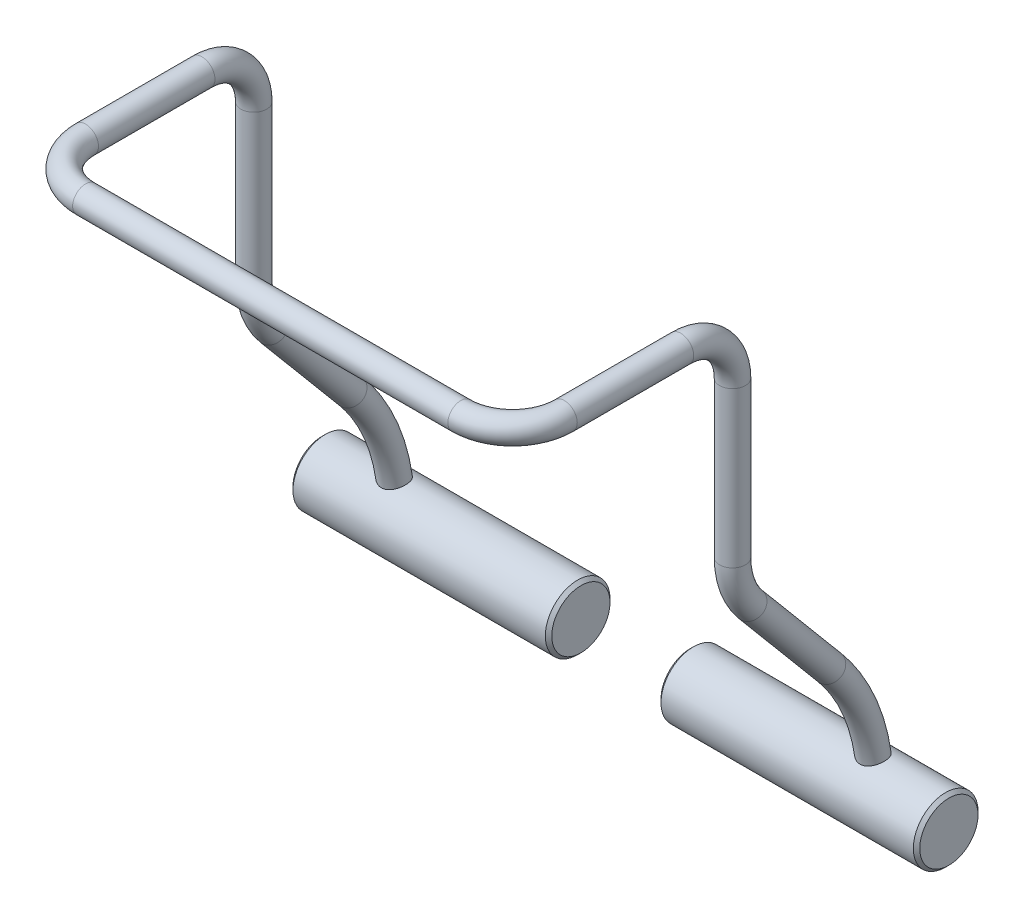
SolidWorks part; units mm, degrees
ref_plane "Face" through (0, 0, 0) normal (0, 0, 1) x (1, 0, 0)
ref_plane "Dessus" through (0, 0, 0) normal (0, 1, 0) x (1, 0, 0)
ref_plane "Droite" through (0, 0, 0) normal (1, 0, 0) x (0, 0, -1)
sketch "Esquisse1" plane through (0, 0, 0) normal (1, 0, 0) x (0, 0, -1)
  line L0 (0, 0) -> (0, 0.2473)
  line L1 (-9.5963, 17.1433) -> (-3.5093, 9.8891)
  line L2 (-11, 33) -> (-11, 21)
  line L3 (-15, 37) -> (-24, 37)
  arc A0 (-15, 37) -> (-11, 33) centre (-15, 33) cw
  arc A1 (-11, 21) -> (-9.5963, 17.1433) centre (-5, 21) ccw
  arc A2 (0, 0.2473) -> (-3.5093, 9.8891) centre (-15, 0.2473) ccw
  dimension "D2" = 4
  dimension "D5" = 6
  dimension "D8" = 15
  dimension "D1" = 37
  dimension "D3" = 13
  dimension "D4" = 11
  dimension "D6" = 12
  dimension "D7" = 140
ref_plane "Plan1" through (0, 37, 0) normal (0, 1, 0) x (-1, 0, 0)
sketch "Esquisse2" plane through (0, 37, 0) normal (0, 1, 0) x (-1, 0, 0)
  line L0 (18.5, 28) -> (4, 28)
  line L1 (-7.0078, 24) -> (12.5696, 24) construction
  arc A0 (4, 28) -> (0, 24) centre (4, 24) ccw
  dimension "D3" = 8
  dimension "D1" = 28
  dimension "D2" = 4
  dimension "D4" = 18.5
curve "Courbe comp.1"
sketch "Esquisse3" plane through (0, 0, 0) normal (0, 1, 0) x (1, 0, 0)
  circle A0 centre (0, 0) radius 1
  dimension "D1" = 2
sweep "Base-Balayage" add profiles "Esquisse3" path "Courbe comp.1"
sketch "Esquisse4" plane through (0, 0, 0) normal (1, 0, 0) x (0, 0, -1)
  circle A0 centre (0, 0) radius 2.5
  dimension "D1" = 5
extrude "Boss.-Extru.2" add sketch "Esquisse4" along normal blind 5.72 and the other way blind 14.28
mirror "Symétrie1" about plane through (-18.5, 37, 28) normal (-1, 0, 0) of "Boss.-Extru.2", "Base-Balayage"
chamfer "Chanfrein1" distance 0.25 angle 45 4 edges at (-14.28, 0, -2.5) (5.72, 0, -2.5) (-42.72, 0, -2.5) (-22.72, 0, -2.5)
